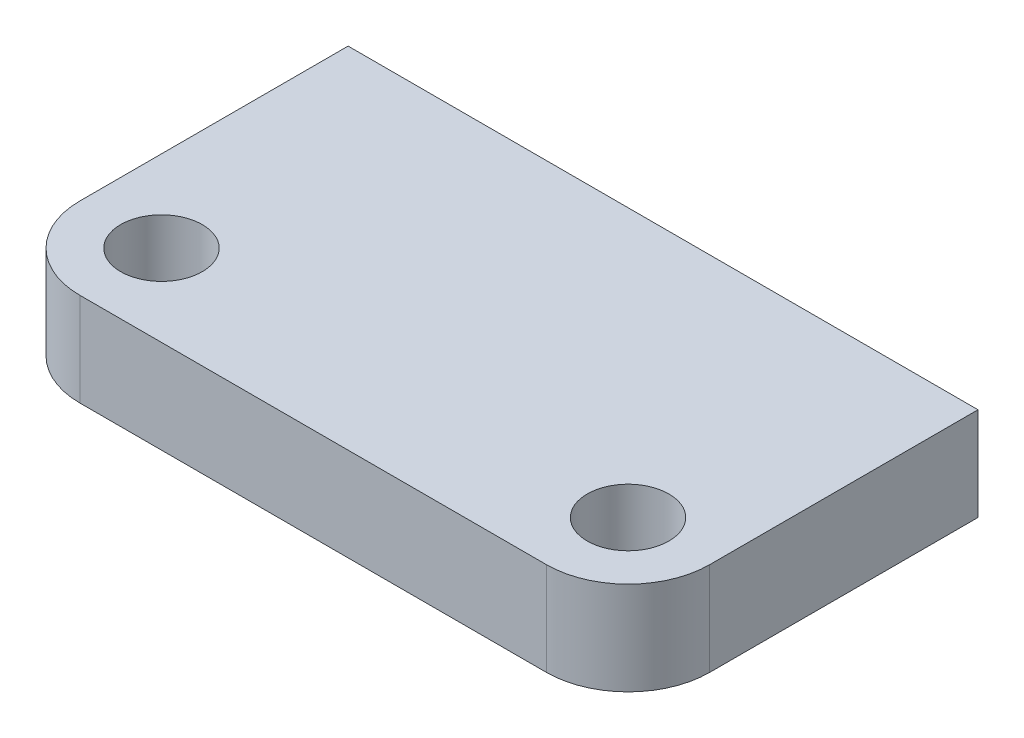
SolidWorks part; units mm, degrees
ref_plane "前视基准面" through (0, 0, 0) normal (0, 0, 1) x (1, 0, 0)
ref_plane "上视基准面" through (0, 0, 0) normal (0, 1, 0) x (1, 0, 0)
ref_plane "右视基准面" through (0, 0, 0) normal (1, 0, 0) x (0, 0, -1)
sketch "草图1" plane through (0, 0, 0) normal (0, 1, 0) x (1, 0, 0)
  line L0 (0, 22.9704) -> (0, -68.59) construction
  line L1 (27, 0) -> (-27, 0)
  line L2 (-27, 0) -> (-27, -23)
  line L3 (-20, -30) -> (20, -30)
  line L4 (-20, -15.9026) -> (-20, -39.6762) construction
  line L5 (-11.9684, -23) -> (-5.1768, -23) construction
  line L6 (27, 0) -> (27, -23)
  circle A0 centre (-20, -23) radius 3.5
  arc A1 (-20, -30) -> (-27, -23) centre (-20, -23) cw
  circle A2 centre (20, -23) radius 3.5
  arc A3 (20, -30) -> (27, -23) centre (20, -23) ccw
  point P15 (-27, -30)
  point P20 (0, -30)
  point P21 (0, 0)
  dimension "D1" = 7
  dimension "D6" = 7
  dimension "D3" = 20
  dimension "D4" = 23
extrude "凸台-拉伸1" add sketch "草图1" along normal blind 8
